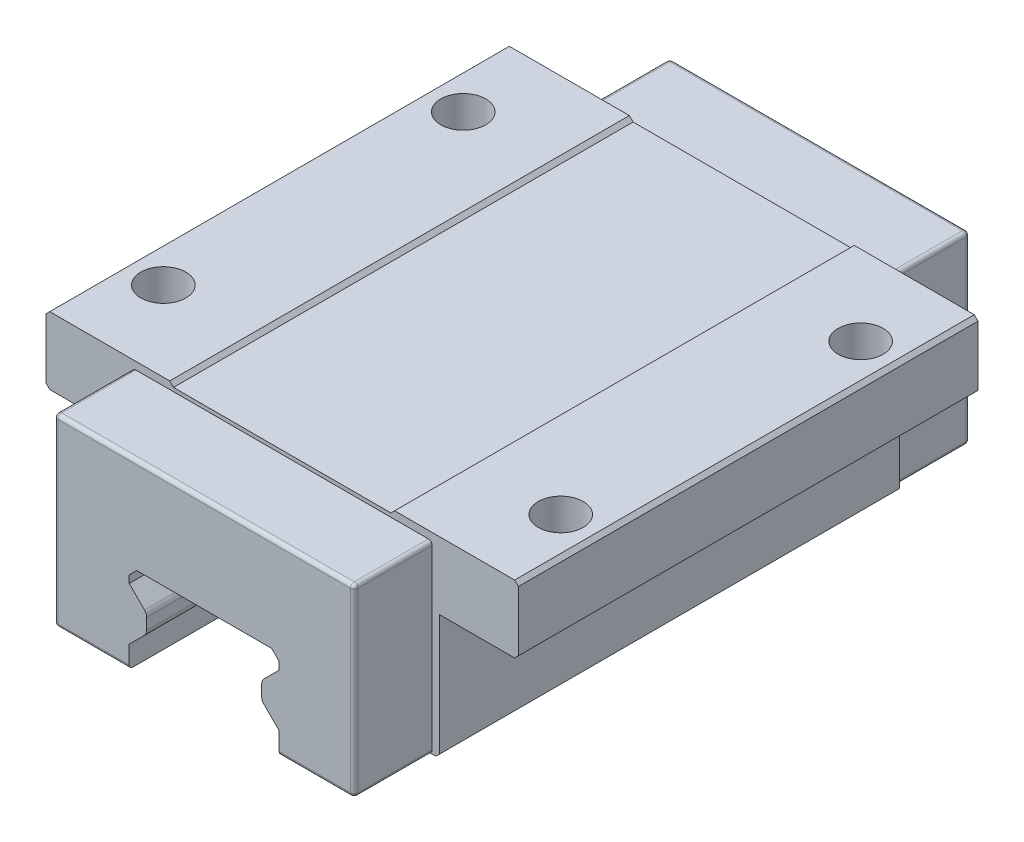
SolidWorks part; units mm, degrees
ref_plane "Front Plane" through (0, 0, 0) normal (0, 0, 1) x (1, 0, 0)
ref_plane "Top Plane" through (0, 0, 0) normal (0, 1, 0) x (1, 0, 0)
ref_plane "Right Plane" through (0, 0, 0) normal (1, 0, 0) x (0, 0, -1)
sketch "Sketch1" plane through (0, 0, 0) normal (0, 0, 1) x (1, 0, 0)
  line L1 (-21, 4.4) -> (21, 4.4)
  line L2 (-21, 4.4) -> (-21, 30)
  line L3 (-21, 30) -> (21, 30)
  line L4 (21, 4.4) -> (21, 30)
  line L5 (-21, 4.4) -> (21, 30) construction
  line L6 (-21, 30) -> (21, 4.4) construction
  point P0 (0, 17.2)
  dimension "D1" = 30
  dimension "D2" = 4.4
  dimension "D3" = 42
extrude "Boss-Extrude1" add sketch "Sketch1" along normal mid plane 61.3
sketch "Sketch2" plane through (0, 0, 0) normal (0, 0, 1) x (1, 0, 0)
  line L0 (-21, 4.4) -> (21, 4.4) construction
  line L1 (-20, 4.4) -> (20, 4.4)
  line L2 (-20, 4.4) -> (-20, 29)
  line L3 (-20, 29) -> (20, 29)
  line L4 (20, 4.4) -> (20, 29)
  line L5 (-20, 29) -> (-21, 29) construction
  line L6 (-21, 30) -> (-21, 4.4) construction
  line L7 (20, 29) -> (20, 30) construction
  line L8 (21, 30) -> (-21, 30) construction
  line L9 (20, 29) -> (21, 29) construction
  line L10 (21, 4.4) -> (21, 30) construction
  point P9 (0, 29)
  dimension "D1" = 1
extrude "Boss-Extrude2" add sketch "Sketch2" along normal mid plane 82.1
sketch "Sketch3" plane through (0, 0, 41.05) normal (0, 0, 1) x (1, 0, 0)
  line L1 (-10, 16.3) -> (10, 16.3)
  line L2 (-10, 16.3) -> (-10, 0)
  line L3 (-10, 0) -> (10, 0)
  line L4 (10, 16.3) -> (10, 0)
  line L5 (-10, 16.3) -> (10, 0) construction
  line L6 (-10, 0) -> (10, 16.3) construction
  point P0 (0, 8.15)
  dimension "D1" = 20
  dimension "D2" = 16.3
extrude "Cut-Extrude1" cut sketch "Sketch3" against normal through all
sketch "Sketch4" plane through (0, 0, 41.05) normal (0, 0, 1) x (1, 0, 0)
  line L0 (-10, 14.3) -> (-10, 7.3)
  line L1 (-10, 16.3) -> (-10, 4.4) construction
  line L2 (-10, 7.3) -> (-7.6667, 9.6333)
  line L3 (-7.6667, 9.6333) -> (-7.6667, 11.9667)
  line L4 (-7.6667, 11.9667) -> (-10, 14.3)
  line L5 (10, 16.3) -> (-10, 16.3) construction
  line L6 (-7.6667, 11.9667) -> (-10, 11.9667) construction
  line L7 (-7.6667, 9.6333) -> (-10, 9.6333) construction
  line L8 (-8.8333, 11.9667) -> (-8.8333, 9.6333) construction
  line L9 (0, 0) -> (0, 16.3) construction
  line L10 (8.8333, 11.9667) -> (8.8333, 9.6333) construction
  line L11 (7.6667, 9.6333) -> (10, 9.6333) construction
  line L12 (7.6667, 11.9667) -> (10, 11.9667) construction
  line L13 (7.6667, 11.9667) -> (10, 14.3)
  line L14 (7.6667, 9.6333) -> (7.6667, 11.9667)
  line L15 (10, 7.3) -> (7.6667, 9.6333)
  line L16 (10, 14.3) -> (10, 7.3)
extrude "Boss-Extrude3" add sketch "Sketch4" against normal up to surface (82.1 mm away)
chamfer "Chamfer1" distance 1 angle 45 2 edges at (10, 16.3, 0) (-10, 16.3, 0)
fillet "Fillet1" radius 1 4 edges at (7.6667, 9.6333, 0) (7.6667, 11.9667, 0) (-7.6667, 9.6333, 0) (-7.6667, 11.9667, 0)
sketch "Sketch5" plane through (0, 0, 30.65) normal (0, 0, 1) x (1, 0, 0)
  line L0 (21, 30) -> (-21, 30) construction
  line L1 (-15, 30) -> (15, 30)
  line L2 (-15, 30) -> (-15, 29.5)
  line L3 (-15, 29.5) -> (15, 29.5)
  line L4 (15, 30) -> (15, 29.5)
  point P6 (0, 29.5)
  dimension "D1" = 30
  dimension "D2" = 0.5
extrude "Cut-Extrude2" cut sketch "Sketch5" against normal through all
chamfer "Chamfer2" distance 0.5 angle 45 6 edges at (21, 30, 0) (21, 4.4, 0) (-21, 4.4, 0) (-21, 30, 0) (15, 29.5, 0) (-15, 29.5, 0)
fillet "Fillet2" radius 0.5 18 edges at (-20, 4.4, -35.85) (15, 4.4, -41.05) (-20, 4.4, 35.85) (-15, 4.4, -41.05) (-15, 4.4, 41.05) (15, 4.4, 41.05) (20, 4.4, 35.85) (-20, 16.7, 41.05) (-20, 16.7, -41.05) (-20, 29, 35.85) (20, 29, 35.85) (20, 16.7, 41.05) (20, 16.7, -41.05) (0, 29, 41.05) (0, 29, -41.05) (20, 4.4, -35.85) (20, 29, -35.85) (-20, 29, -35.85)
sketch "Sketch7" plane through (0, 0, 0) normal (0, 0, 1) x (1, 0, 0)
  line L0 (-20.5, 30) -> (-31.5, 30)
  line L1 (-31.5, 30) -> (-31.5, 21)
  line L2 (-20.5, 30) -> (-20.5, 11)
  line L3 (-21, 29.5) -> (-21, 4.9) construction
  line L4 (-21, 11) -> (-20.5, 11)
  line L5 (-31.5, 21) -> (-31, 21)
  line L6 (0, 0) -> (0, 29.5) construction
  line L7 (-14.5, 29.5) -> (14.5, 29.5) construction
  line L8 (31.5, 21) -> (31, 21)
  line L9 (21, 11) -> (20.5, 11)
  line L10 (20.5, 30) -> (20.5, 11)
  line L11 (31.5, 30) -> (31.5, 21)
  line L12 (20.5, 30) -> (31.5, 30)
  arc A1 (-31, 21) -> (-21, 11) centre (-31, 11) cw
  arc A2 (31, 21) -> (21, 11) centre (31, 11) ccw
  point P22 (-31.25, 21)
  dimension "D1" = 63
  dimension "D2" = 9
  dimension "D3" = 0.5
extrude "Boss-Extrude4" add sketch "Sketch7" along normal mid plane 31.5
sketch "Sketch8" plane through (0, 0, 0) normal (0, 0, 1) x (1, 0, 0)
  line L0 (-31.5, 21) -> (-31.5, 30)
  line L9 (31.5, 21) -> (31.5, 30)
  line L10 (31.5, 21) -> (20.5, 21)
  line L11 (31.5, 30) -> (20.5, 30)
  line L13 (20.5, 30) -> (20.5, 21)
  line L14 (-31.5, 21) -> (-20, 21)
  line L15 (-31.5, 30) -> (-20, 30)
  line L16 (-20, 21) -> (-20, 30)
  line L17 (-20, 28.5) -> (-20, 4.9) construction
extrude "Boss-Extrude5" add sketch "Sketch8" along normal mid plane 61.3
chamfer "Chamfer3" distance 0.5 angle 45 4 edges at (-31.5, 21, 0) (-31.5, 30, 0) (31.5, 21, 0) (31.5, 30, 0)
fillet "Fillet3" radius 5 4 edges at (-21, 16, 15.75) (-21, 16, -15.75) (21, 16, -15.75) (21, 16, 15.75)
sketch "Sketch6" plane through (0, 30, 0) normal (0, 1, 0) x (1, 0, 0)
  line L1 (0, 0) -> (26.5, -20) construction
  line L3 (0, 0) -> (-26.5, -20) construction
  circle A1 centre (-26.5, -20) radius 3
  circle A2 centre (26.5, -20) radius 3
  dimension "D1" = 6
  dimension "D2" = 53
  dimension "D3" = 20
extrude "Cut-Extrude3" cut sketch "Sketch6" against normal blind 9
mirror "Mirror1" about plane through (0, 0, 0) normal (0, 0, 1) of "Cut-Extrude3"
equation "\"D2@Sketch4\"=\"D1@Sketch4\"*3.5"
